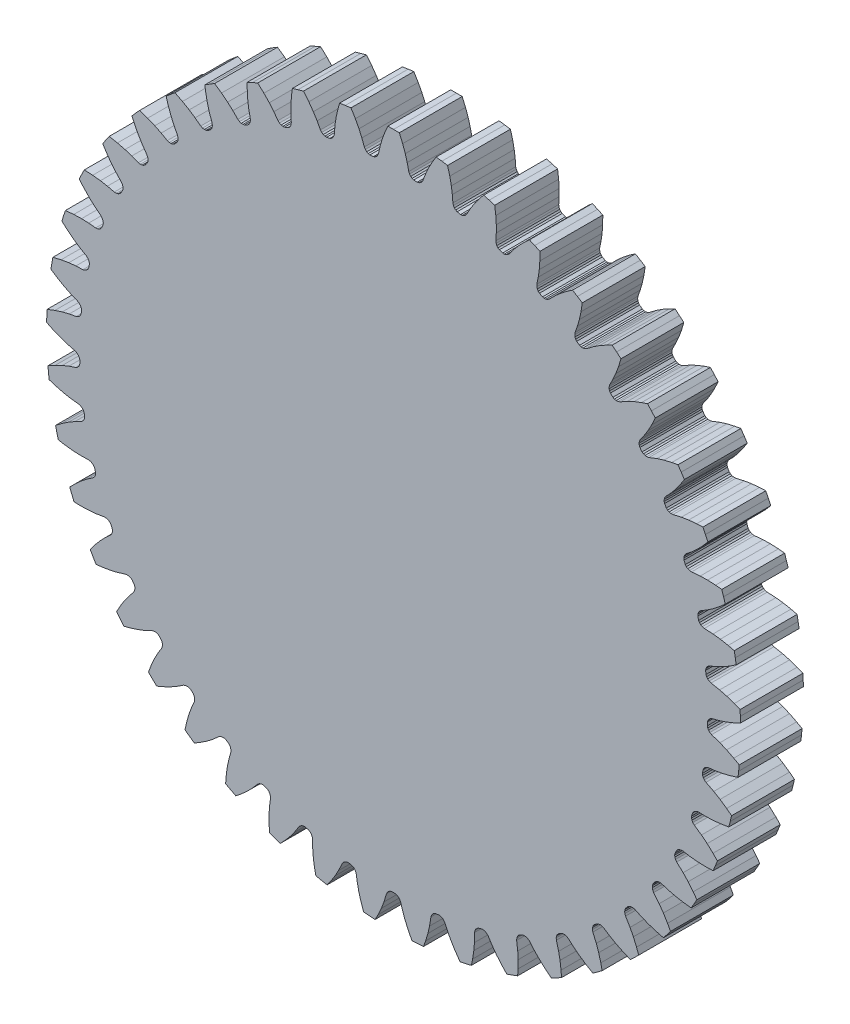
SolidWorks part; units mm, degrees
ref_plane "Ebene vorne" through (0, 0, 0) normal (0, 0, 1) x (1, 0, 0)
ref_plane "Ebene oben" through (0, 0, 0) normal (0, 1, 0) x (1, 0, 0)
ref_plane "Ebene rechts" through (0, 0, 0) normal (1, 0, 0) x (0, 0, -1)
sketch "Skizze1" plane through (0, 0, 0) normal (0, 0, 1) x (1, 0, 0)
  line L0 (1.1477, -5.3994) -> (1.058, -5.4177)
  line L1 (1.058, -5.4177) -> (0.9807, -5.3081)
  line L2 (0.9807, -5.3081) -> (0.9157, -5.2029)
  line L3 (0.9157, -5.2029) -> (0.8627, -5.1029)
  line L4 (0.8627, -5.1029) -> (0.816, -5.0004)
  line L5 (0.816, -5.0004) -> (0.7968, -4.9748)
  line L6 (0.7968, -4.9748) -> (0.7747, -4.9569)
  line L7 (0.7747, -4.9569) -> (0.749, -4.9457)
  line L8 (0.749, -4.9457) -> (0.7224, -4.9422)
  line L9 (0.7224, -4.9422) -> (0.6678, -4.9498)
  line L10 (0.6678, -4.9498) -> (0.6432, -4.9606)
  line L11 (0.6432, -4.9606) -> (0.6216, -4.9784)
  line L12 (0.6216, -4.9784) -> (0.6048, -5.0027)
  line L13 (0.6048, -5.0027) -> (0.5935, -5.0332)
  line L14 (0.5935, -5.0332) -> (0.5723, -5.1702)
  line L15 (0.5723, -5.1702) -> (0.5462, -5.2837)
  line L16 (0.5462, -5.2837) -> (0.5098, -5.4056)
  line L17 (0.5098, -5.4056) -> (0.4763, -5.4994)
  line L18 (0.4763, -5.4994) -> (0.3851, -5.5066)
  line L19 (1.888, -5.1871) -> (1.8017, -5.2177)
  line L20 (1.8017, -5.2177) -> (1.7099, -5.12)
  line L21 (1.7099, -5.12) -> (1.6309, -5.0248)
  line L22 (1.6309, -5.0248) -> (1.5645, -4.9332)
  line L23 (1.5645, -4.9332) -> (1.504, -4.8382)
  line L24 (1.504, -4.8382) -> (1.4814, -4.8155)
  line L25 (1.4814, -4.8155) -> (1.457, -4.8008)
  line L26 (1.457, -4.8008) -> (1.43, -4.7933)
  line L27 (1.43, -4.7933) -> (1.4032, -4.7935)
  line L28 (1.4032, -4.7935) -> (1.3502, -4.8087)
  line L29 (1.3502, -4.8087) -> (1.3274, -4.8228)
  line L30 (1.3274, -4.8228) -> (1.3084, -4.8435)
  line L31 (1.3084, -4.8435) -> (1.2951, -4.8698)
  line L32 (1.2951, -4.8698) -> (1.2882, -4.9016)
  line L33 (1.2882, -4.9016) -> (1.2863, -5.0402)
  line L34 (1.2863, -5.0402) -> (1.2763, -5.1563)
  line L35 (1.2763, -5.1563) -> (1.2571, -5.2821)
  line L36 (1.2571, -5.2821) -> (1.237, -5.3796)
  line L37 (1.237, -5.3796) -> (1.1477, -5.3994)
  line L38 (2.5915, -4.8739) -> (2.5103, -4.9162)
  line L39 (2.5103, -4.9162) -> (2.4058, -4.8322)
  line L40 (2.4058, -4.8322) -> (2.3143, -4.7489)
  line L41 (2.3143, -4.7489) -> (2.2359, -4.6675)
  line L42 (2.2359, -4.6675) -> (2.1627, -4.5818)
  line L43 (2.1627, -4.5818) -> (2.1372, -4.5624)
  line L44 (2.1372, -4.5624) -> (2.111, -4.5513)
  line L45 (2.111, -4.5513) -> (2.0832, -4.5477)
  line L46 (2.0832, -4.5477) -> (2.0567, -4.5516)
  line L47 (2.0567, -4.5516) -> (2.0063, -4.574)
  line L48 (2.0063, -4.574) -> (1.9856, -4.5911)
  line L49 (1.9856, -4.5911) -> (1.9698, -4.6142)
  line L50 (1.9698, -4.6142) -> (1.9603, -4.6422)
  line L51 (1.9603, -4.6422) -> (1.9579, -4.6747)
  line L52 (1.9579, -4.6747) -> (1.9752, -4.8121)
  line L53 (1.9752, -4.8121) -> (1.9815, -4.9285)
  line L54 (1.9815, -4.9285) -> (1.98, -5.0557)
  line L55 (1.98, -5.0557) -> (1.9737, -5.1551)
  line L56 (1.9737, -5.1551) -> (1.888, -5.1871)
  line L57 (3.2446, -4.4658) -> (3.1701, -4.5189)
  line L58 (3.1701, -4.5189) -> (3.0549, -4.4503)
  line L59 (3.0549, -4.4503) -> (2.9527, -4.3806)
  line L60 (2.9527, -4.3806) -> (2.8637, -4.3109)
  line L61 (2.8637, -4.3109) -> (2.7793, -4.2362)
  line L62 (2.7793, -4.2362) -> (2.7514, -4.2206)
  line L63 (2.7514, -4.2206) -> (2.7239, -4.2132)
  line L64 (2.7239, -4.2132) -> (2.6958, -4.2135)
  line L65 (2.6958, -4.2135) -> (2.6701, -4.2211)
  line L66 (2.6701, -4.2211) -> (2.6234, -4.2503)
  line L67 (2.6234, -4.2503) -> (2.6053, -4.2701)
  line L68 (2.6053, -4.2701) -> (2.5928, -4.2952)
  line L69 (2.5928, -4.2952) -> (2.5872, -4.3242)
  line L70 (2.5872, -4.3242) -> (2.5894, -4.3567)
  line L71 (2.5894, -4.3567) -> (2.6257, -4.4904)
  line L72 (2.6257, -4.4904) -> (2.6481, -4.6047)
  line L73 (2.6481, -4.6047) -> (2.6644, -4.7309)
  line L74 (2.6644, -4.7309) -> (2.6719, -4.8302)
  line L75 (2.6719, -4.8302) -> (2.5915, -4.8739)
  line L76 (3.8345, -3.9708) -> (3.7682, -4.0338)
  line L77 (3.7682, -4.0338) -> (3.6446, -3.9818)
  line L78 (3.6446, -3.9818) -> (3.5337, -3.9271)
  line L79 (3.5337, -3.9271) -> (3.4358, -3.8704)
  line L80 (3.4358, -3.8704) -> (3.3418, -3.8082)
  line L81 (3.3418, -3.8082) -> (3.312, -3.7966)
  line L82 (3.312, -3.7966) -> (3.2838, -3.7931)
  line L83 (3.2838, -3.7931) -> (3.256, -3.7973)
  line L84 (3.256, -3.7973) -> (3.2316, -3.8084)
  line L85 (3.2316, -3.8084) -> (3.1894, -3.8438)
  line L86 (3.1894, -3.8438) -> (3.1742, -3.8659)
  line L87 (3.1742, -3.8659) -> (3.1653, -3.8925)
  line L88 (3.1653, -3.8925) -> (3.1639, -3.922)
  line L89 (3.1639, -3.922) -> (3.1705, -3.9539)
  line L90 (3.1705, -3.9539) -> (3.2251, -4.0813)
  line L91 (3.2251, -4.0813) -> (3.2632, -4.1914)
  line L92 (3.2632, -4.1914) -> (3.2969, -4.3141)
  line L93 (3.2969, -4.3141) -> (3.3182, -4.4114)
  line L94 (3.3182, -4.4114) -> (3.2446, -4.4658)
  line L95 (4.3498, -3.3985) -> (4.2929, -3.4701)
  line L96 (4.2929, -3.4701) -> (4.1633, -3.4359)
  line L97 (4.1633, -3.4359) -> (4.0458, -3.397)
  line L98 (4.0458, -3.397) -> (3.941, -3.3545)
  line L99 (3.941, -3.3545) -> (3.8393, -3.306)
  line L100 (3.8393, -3.306) -> (3.8081, -3.2987)
  line L101 (3.8081, -3.2987) -> (3.7797, -3.2992)
  line L102 (3.7797, -3.2992) -> (3.7528, -3.3072)
  line L103 (3.7528, -3.3072) -> (3.7301, -3.3216)
  line L104 (3.7301, -3.3216) -> (3.6933, -3.3625)
  line L105 (3.6933, -3.3625) -> (3.6813, -3.3866)
  line L106 (3.6813, -3.3866) -> (3.6762, -3.4141)
  line L107 (3.6762, -3.4141) -> (3.6789, -3.4435)
  line L108 (3.6789, -3.4435) -> (3.69, -3.4742)
  line L109 (3.69, -3.4742) -> (3.7617, -3.5927)
  line L110 (3.7617, -3.5927) -> (3.8147, -3.6965)
  line L111 (3.8147, -3.6965) -> (3.8652, -3.8133)
  line L112 (3.8652, -3.8133) -> (3.8998, -3.9067)
  line L113 (3.8998, -3.9067) -> (3.8345, -3.9708)
  line L114 (4.7805, -2.76) -> (4.7341, -2.8389)
  line L115 (4.7341, -2.8389) -> (4.6009, -2.823)
  line L116 (4.6009, -2.823) -> (4.4792, -2.8009)
  line L117 (4.4792, -2.8009) -> (4.3695, -2.7734)
  line L118 (4.3695, -2.7734) -> (4.262, -2.7395)
  line L119 (4.262, -2.7395) -> (4.2302, -2.7366)
  line L120 (4.2302, -2.7366) -> (4.2021, -2.7411)
  line L121 (4.2021, -2.7411) -> (4.1766, -2.7527)
  line L122 (4.1766, -2.7527) -> (4.1561, -2.7701)
  line L123 (4.1561, -2.7701) -> (4.1253, -2.8158)
  line L124 (4.1253, -2.8158) -> (4.1168, -2.8413)
  line L125 (4.1168, -2.8413) -> (4.1156, -2.8693)
  line L126 (4.1156, -2.8693) -> (4.1224, -2.898)
  line L127 (4.1224, -2.898) -> (4.1376, -2.9268)
  line L128 (4.1376, -2.9268) -> (4.2251, -3.0342)
  line L129 (4.2251, -3.0342) -> (4.2921, -3.1296)
  line L130 (4.2921, -3.1296) -> (4.3583, -3.2382)
  line L131 (4.3583, -3.2382) -> (4.4056, -3.3259)
  line L132 (4.4056, -3.3259) -> (4.3498, -3.3985)
  line L133 (5.1181, -2.0678) -> (5.0831, -2.1524)
  line L134 (5.0831, -2.1524) -> (4.949, -2.1552)
  line L135 (4.949, -2.1552) -> (4.8255, -2.1503)
  line L136 (4.8255, -2.1503) -> (4.713, -2.1383)
  line L137 (4.713, -2.1383) -> (4.6018, -2.1197)
  line L138 (4.6018, -2.1197) -> (4.5699, -2.1213)
  line L139 (4.5699, -2.1213) -> (4.5427, -2.1296)
  line L140 (4.5427, -2.1296) -> (4.519, -2.1447)
  line L141 (4.519, -2.1447) -> (4.5012, -2.1647)
  line L142 (4.5012, -2.1647) -> (4.477, -2.2143)
  line L143 (4.477, -2.2143) -> (4.4722, -2.2407)
  line L144 (4.4722, -2.2407) -> (4.4749, -2.2686)
  line L145 (4.4749, -2.2686) -> (4.4856, -2.2961)
  line L146 (4.4856, -2.2961) -> (4.5046, -2.3225)
  line L147 (4.5046, -2.3225) -> (4.6063, -2.4167)
  line L148 (4.6063, -2.4167) -> (4.6858, -2.5018)
  line L149 (4.6858, -2.5018) -> (4.7665, -2.6001)
  line L150 (4.7665, -2.6001) -> (4.8256, -2.6804)
  line L151 (4.8256, -2.6804) -> (4.7805, -2.76)
  line L152 (5.356, -1.3354) -> (5.3332, -1.424)
  line L153 (5.3332, -1.424) -> (5.2008, -1.4455)
  line L154 (5.2008, -1.4455) -> (5.0777, -1.4578)
  line L155 (5.0777, -1.4578) -> (4.9647, -1.4616)
  line L156 (4.9647, -1.4616) -> (4.8521, -1.4586)
  line L157 (4.8521, -1.4586) -> (4.8206, -1.4646)
  line L158 (4.8206, -1.4646) -> (4.7948, -1.4766)
  line L159 (4.7948, -1.4766) -> (4.7735, -1.4949)
  line L160 (4.7735, -1.4949) -> (4.7587, -1.5172)
  line L161 (4.7587, -1.5172) -> (4.7416, -1.5696)
  line L162 (4.7416, -1.5696) -> (4.7405, -1.5964)
  line L163 (4.7405, -1.5964) -> (4.7471, -1.6237)
  line L164 (4.7471, -1.6237) -> (4.7615, -1.6495)
  line L165 (4.7615, -1.6495) -> (4.784, -1.673)
  line L166 (4.784, -1.673) -> (4.8978, -1.7521)
  line L167 (4.8978, -1.7521) -> (4.9884, -1.8253)
  line L168 (4.9884, -1.8253) -> (5.082, -1.9115)
  line L169 (5.082, -1.9115) -> (5.1516, -1.9827)
  line L170 (5.1516, -1.9827) -> (5.1181, -2.0678)
  line L171 (5.4898, -0.577) -> (5.4794, -0.6679)
  line L172 (5.4794, -0.6679) -> (5.3514, -0.7076)
  line L173 (5.3514, -0.7076) -> (5.2312, -0.7369)
  line L174 (5.2312, -0.7369) -> (5.1198, -0.7564)
  line L175 (5.1198, -0.7564) -> (5.0078, -0.7692)
  line L176 (5.0078, -0.7692) -> (4.9775, -0.7795)
  line L177 (4.9775, -0.7795) -> (4.9537, -0.795)
  line L178 (4.9537, -0.795) -> (4.9351, -0.816)
  line L179 (4.9351, -0.816) -> (4.9235, -0.8402)
  line L180 (4.9235, -0.8402) -> (4.9139, -0.8944)
  line L181 (4.9139, -0.8944) -> (4.9166, -0.9211)
  line L182 (4.9166, -0.9211) -> (4.9268, -0.9472)
  line L183 (4.9268, -0.9472) -> (4.9447, -0.9707)
  line L184 (4.9447, -0.9707) -> (4.9703, -0.9909)
  line L185 (4.9703, -0.9909) -> (5.094, -1.0534)
  line L186 (5.094, -1.0534) -> (5.1939, -1.1133)
  line L187 (5.1939, -1.1133) -> (5.2986, -1.1856)
  line L188 (5.2986, -1.1856) -> (5.3774, -1.2464)
  line L189 (5.3774, -1.2464) -> (5.356, -1.3354)
  line L190 (5.5166, 0.1926) -> (5.5191, 0.1012)
  line L191 (5.5191, 0.1012) -> (5.3978, 0.0441)
  line L192 (5.3978, 0.0441) -> (5.2829, -0.0017)
  line L193 (5.2829, -0.0017) -> (5.1752, -0.0365)
  line L194 (5.1752, -0.0365) -> (5.0662, -0.0647)
  line L195 (5.0662, -0.0647) -> (5.0376, -0.0791)
  line L196 (5.0376, -0.0791) -> (5.0161, -0.0978)
  line L197 (5.0161, -0.0978) -> (5.0006, -0.1212)
  line L198 (5.0006, -0.1212) -> (4.9925, -0.1468)
  line L199 (4.9925, -0.1468) -> (4.9906, -0.2018)
  line L200 (4.9906, -0.2018) -> (4.9969, -0.2279)
  line L201 (4.9969, -0.2279) -> (5.0107, -0.2523)
  line L202 (5.0107, -0.2523) -> (5.0317, -0.2731)
  line L203 (5.0317, -0.2731) -> (5.0598, -0.2895)
  line L204 (5.0598, -0.2895) -> (5.191, -0.3342)
  line L205 (5.191, -0.3342) -> (5.2983, -0.3796)
  line L206 (5.2983, -0.3796) -> (5.412, -0.4366)
  line L207 (5.412, -0.4366) -> (5.4986, -0.4859)
  line L208 (5.4986, -0.4859) -> (5.4898, -0.577)
  line L209 (5.4361, 0.9585) -> (5.4513, 0.8683)
  line L210 (5.4513, 0.8683) -> (5.3391, 0.7949)
  line L211 (5.3391, 0.7949) -> (5.2317, 0.7336)
  line L212 (5.2317, 0.7336) -> (5.1299, 0.6841)
  line L213 (5.1299, 0.6841) -> (5.0259, 0.641)
  line L214 (5.0259, 0.641) -> (4.9995, 0.6227)
  line L215 (4.9995, 0.6227) -> (4.9809, 0.6013)
  line L216 (4.9809, 0.6013) -> (4.9688, 0.5759)
  line L217 (4.9688, 0.5759) -> (4.9644, 0.5495)
  line L218 (4.9644, 0.5495) -> (4.9701, 0.4947)
  line L219 (4.9701, 0.4947) -> (4.98, 0.4697)
  line L220 (4.98, 0.4697) -> (4.9971, 0.4475)
  line L221 (4.9971, 0.4475) -> (5.0207, 0.4298)
  line L222 (5.0207, 0.4298) -> (5.0509, 0.4175)
  line L223 (5.0509, 0.4175) -> (5.187, 0.3915)
  line L224 (5.187, 0.3915) -> (5.2996, 0.3615)
  line L225 (5.2996, 0.3615) -> (5.4201, 0.3208)
  line L226 (5.4201, 0.3208) -> (5.5127, 0.2841)
  line L227 (5.5127, 0.2841) -> (5.5166, 0.1926)
  line L228 (5.2498, 1.7058) -> (5.2774, 1.6185)
  line L229 (5.2774, 1.6185) -> (5.1765, 1.5302)
  line L230 (5.1765, 1.5302) -> (5.0787, 1.4545)
  line L231 (5.0787, 1.4545) -> (4.9848, 1.3914)
  line L232 (4.9848, 1.3914) -> (4.8877, 1.3342)
  line L233 (4.8877, 1.3342) -> (4.8642, 1.3125)
  line L234 (4.8642, 1.3125) -> (4.8488, 1.2886)
  line L235 (4.8488, 1.2886) -> (4.8403, 1.2619)
  line L236 (4.8403, 1.2619) -> (4.8396, 1.235)
  line L237 (4.8396, 1.235) -> (4.8529, 1.1816)
  line L238 (4.8529, 1.1816) -> (4.8662, 1.1582)
  line L239 (4.8662, 1.1582) -> (4.8862, 1.1386)
  line L240 (4.8862, 1.1386) -> (4.912, 1.1244)
  line L241 (4.912, 1.1244) -> (4.9436, 1.1164)
  line L242 (4.9436, 1.1164) -> (5.082, 1.1096)
  line L243 (5.082, 1.1096) -> (5.1977, 1.0955)
  line L244 (5.1977, 1.0955) -> (5.3227, 1.072)
  line L245 (5.3227, 1.072) -> (5.4195, 1.0485)
  line L246 (5.4195, 1.0485) -> (5.4361, 0.9585)
  line L247 (4.9613, 2.4198) -> (5.0008, 2.3372)
  line L248 (5.0008, 2.3372) -> (4.9132, 2.2357)
  line L249 (4.9132, 2.2357) -> (4.8268, 2.1472)
  line L250 (4.8268, 2.1472) -> (4.7426, 2.0716)
  line L251 (4.7426, 2.0716) -> (4.6545, 2.0015)
  line L252 (4.6545, 2.0015) -> (4.6342, 1.9767)
  line L253 (4.6342, 1.9767) -> (4.6222, 1.9509)
  line L254 (4.6222, 1.9509) -> (4.6176, 1.9232)
  line L255 (4.6176, 1.9232) -> (4.6206, 1.8966)
  line L256 (4.6206, 1.8966) -> (4.6412, 1.8455)
  line L257 (4.6412, 1.8455) -> (4.6576, 1.8242)
  line L258 (4.6576, 1.8242) -> (4.6802, 1.8075)
  line L259 (4.6802, 1.8075) -> (4.7077, 1.7971)
  line L260 (4.7077, 1.7971) -> (4.7401, 1.7935)
  line L261 (4.7401, 1.7935) -> (4.8782, 1.8061)
  line L262 (4.8782, 1.8061) -> (4.9946, 1.8082)
  line L263 (4.9946, 1.8082) -> (5.1217, 1.8024)
  line L264 (5.1217, 1.8024) -> (5.2208, 1.7926)
  line L265 (5.2208, 1.7926) -> (5.2498, 1.7058)
  line L266 (4.5763, 3.0867) -> (4.6268, 3.0105)
  line L267 (4.6268, 3.0105) -> (4.5542, 2.8977)
  line L268 (4.5542, 2.8977) -> (4.481, 2.7981)
  line L269 (4.481, 2.7981) -> (4.4082, 2.7115)
  line L270 (4.4082, 2.7115) -> (4.3306, 2.6298)
  line L271 (4.3306, 2.6298) -> (4.314, 2.6024)
  line L272 (4.314, 2.6024) -> (4.3057, 2.5752)
  line L273 (4.3057, 2.5752) -> (4.305, 2.5472)
  line L274 (4.305, 2.5472) -> (4.3117, 2.5212)
  line L275 (4.3117, 2.5212) -> (4.3392, 2.4734)
  line L276 (4.3392, 2.4734) -> (4.3584, 2.4547)
  line L277 (4.3584, 2.4547) -> (4.3831, 2.4413)
  line L278 (4.3831, 2.4413) -> (4.4118, 2.4348)
  line L279 (4.4118, 2.4348) -> (4.4444, 2.4358)
  line L280 (4.4444, 2.4358) -> (4.5793, 2.4674)
  line L281 (4.5793, 2.4674) -> (4.6944, 2.4858)
  line L282 (4.6944, 2.4858) -> (4.821, 2.4976)
  line L283 (4.821, 2.4976) -> (4.9206, 2.5017)
  line L284 (4.9206, 2.5017) -> (4.9613, 2.4198)
  line L285 (4.1022, 3.6936) -> (4.1628, 3.6251)
  line L286 (4.1628, 3.6251) -> (4.1066, 3.5034)
  line L287 (4.1066, 3.5034) -> (4.048, 3.3945)
  line L288 (4.048, 3.3945) -> (3.9879, 3.2986)
  line L289 (3.9879, 3.2986) -> (3.9225, 3.2069)
  line L290 (3.9225, 3.2069) -> (3.9099, 3.1775)
  line L291 (3.9099, 3.1775) -> (3.9054, 3.1494)
  line L292 (3.9054, 3.1494) -> (3.9086, 3.1215)
  line L293 (3.9086, 3.1215) -> (3.9188, 3.0967)
  line L294 (3.9188, 3.0967) -> (3.9528, 3.0533)
  line L295 (3.9528, 3.0533) -> (3.9744, 3.0374)
  line L296 (3.9744, 3.0374) -> (4.0006, 3.0275)
  line L297 (4.0006, 3.0275) -> (4.03, 3.0251)
  line L298 (4.03, 3.0251) -> (4.0621, 3.0306)
  line L299 (4.0621, 3.0306) -> (4.1914, 3.0807)
  line L300 (4.1914, 3.0807) -> (4.3027, 3.1149)
  line L301 (4.3027, 3.1149) -> (4.4265, 3.1443)
  line L302 (4.4265, 3.1443) -> (4.5245, 3.1622)
  line L303 (4.5245, 3.1622) -> (4.5763, 3.0867)
  line L304 (3.5482, 4.2286) -> (3.6178, 4.1692)
  line L305 (3.6178, 4.1692) -> (3.5791, 4.0408)
  line L306 (3.5791, 4.0408) -> (3.5362, 3.9248)
  line L307 (3.5362, 3.9248) -> (3.49, 3.8215)
  line L308 (3.49, 3.8215) -> (3.438, 3.7216)
  line L309 (3.438, 3.7216) -> (3.4296, 3.6907)
  line L310 (3.4296, 3.6907) -> (3.4291, 3.6623)
  line L311 (3.4291, 3.6623) -> (3.4361, 3.6351)
  line L312 (3.4361, 3.6351) -> (3.4497, 3.612)
  line L313 (3.4497, 3.612) -> (3.4894, 3.5737)
  line L314 (3.4894, 3.5737) -> (3.513, 3.5609)
  line L315 (3.513, 3.5609) -> (3.5404, 3.5548)
  line L316 (3.5404, 3.5548) -> (3.5698, 3.5565)
  line L317 (3.5698, 3.5565) -> (3.6008, 3.5665)
  line L318 (3.6008, 3.5665) -> (3.7218, 3.634)
  line L319 (3.7218, 3.634) -> (3.8273, 3.6834)
  line L320 (3.8273, 3.6834) -> (3.9458, 3.7297)
  line L321 (3.9458, 3.7297) -> (4.0404, 3.7611)
  line L322 (4.0404, 3.7611) -> (4.1022, 3.6936)
  line L323 (2.9252, 4.6812) -> (3.0023, 4.6321)
  line L324 (3.0023, 4.6321) -> (2.9819, 4.4996)
  line L325 (2.9819, 4.4996) -> (2.9555, 4.3788)
  line L326 (2.9555, 4.3788) -> (2.9242, 4.2701)
  line L327 (2.9242, 4.2701) -> (2.8866, 4.1638)
  line L328 (2.8866, 4.1638) -> (2.8826, 4.1321)
  line L329 (2.8826, 4.1321) -> (2.8861, 4.1039)
  line L330 (2.8861, 4.1039) -> (2.8968, 4.0779)
  line L331 (2.8968, 4.0779) -> (2.9135, 4.0569)
  line L332 (2.9135, 4.0569) -> (2.958, 4.0245)
  line L333 (2.958, 4.0245) -> (2.9832, 4.0152)
  line L334 (2.9832, 4.0152) -> (3.0112, 4.013)
  line L335 (3.0112, 4.013) -> (3.0401, 4.0187)
  line L336 (3.0401, 4.0187) -> (3.0694, 4.0329)
  line L337 (3.0694, 4.0329) -> (3.1798, 4.1166)
  line L338 (3.1798, 4.1166) -> (3.2775, 4.1802)
  line L339 (3.2775, 4.1802) -> (3.3883, 4.2426)
  line L340 (3.3883, 4.2426) -> (3.4776, 4.2868)
  line L341 (3.4776, 4.2868) -> (3.5482, 4.2286)
  line L342 (2.2452, 5.0428) -> (2.3285, 5.0049)
  line L343 (2.3285, 5.0049) -> (2.3266, 4.8708)
  line L344 (2.3266, 4.8708) -> (2.3174, 4.7475)
  line L345 (2.3174, 4.7475) -> (2.3015, 4.6355)
  line L346 (2.3015, 4.6355) -> (2.279, 4.5251)
  line L347 (2.279, 4.5251) -> (2.2794, 4.493)
  line L348 (2.2794, 4.493) -> (2.2868, 4.4656)
  line L349 (2.2868, 4.4656) -> (2.3011, 4.4414)
  line L350 (2.3011, 4.4414) -> (2.3205, 4.4229)
  line L351 (2.3205, 4.4229) -> (2.3692, 4.397)
  line L352 (2.3692, 4.397) -> (2.3954, 4.3913)
  line L353 (2.3954, 4.3913) -> (2.4234, 4.393)
  line L354 (2.4234, 4.393) -> (2.4512, 4.4027)
  line L355 (2.4512, 4.4027) -> (2.4783, 4.4208)
  line L356 (2.4783, 4.4208) -> (2.576, 4.5191)
  line L357 (2.576, 4.5191) -> (2.6638, 4.5957)
  line L358 (2.6638, 4.5957) -> (2.7649, 4.6729)
  line L359 (2.7649, 4.6729) -> (2.8472, 4.7291)
  line L360 (2.8472, 4.7291) -> (2.9252, 4.6812)
  line L361 (1.5215, 5.3062) -> (1.6093, 5.2802)
  line L362 (1.6093, 5.2802) -> (1.6261, 5.1472)
  line L363 (1.6261, 5.1472) -> (1.6341, 5.0238)
  line L364 (1.6341, 5.0238) -> (1.6339, 4.9107)
  line L365 (1.6339, 4.9107) -> (1.6271, 4.7982)
  line L366 (1.6271, 4.7982) -> (1.632, 4.7666)
  line L367 (1.632, 4.7666) -> (1.6431, 4.7404)
  line L368 (1.6431, 4.7404) -> (1.6605, 4.7184)
  line L369 (1.6605, 4.7184) -> (1.6824, 4.7028)
  line L370 (1.6824, 4.7028) -> (1.7341, 4.684)
  line L371 (1.7341, 4.684) -> (1.7609, 4.6819)
  line L372 (1.7609, 4.6819) -> (1.7884, 4.6875)
  line L373 (1.7884, 4.6875) -> (1.8146, 4.701)
  line L374 (1.8146, 4.701) -> (1.8389, 4.7227)
  line L375 (1.8389, 4.7227) -> (1.922, 4.8337)
  line L376 (1.922, 4.8337) -> (1.9983, 4.9217)
  line L377 (1.9983, 4.9217) -> (2.0877, 5.0122)
  line L378 (2.0877, 5.0122) -> (2.1613, 5.0793)
  line L379 (2.1613, 5.0793) -> (2.2452, 5.0428)
  line L380 (0.7682, 5.4663) -> (0.8587, 5.4528)
  line L381 (0.8587, 5.4528) -> (0.8939, 5.3234)
  line L382 (0.8939, 5.3234) -> (0.919, 5.2023)
  line L383 (0.919, 5.2023) -> (0.9346, 5.0903)
  line L384 (0.9346, 5.0903) -> (0.9435, 4.9779)
  line L385 (0.9435, 4.9779) -> (0.9527, 4.9473)
  line L386 (0.9527, 4.9473) -> (0.9674, 4.9229)
  line L387 (0.9674, 4.9229) -> (0.9877, 4.9036)
  line L388 (0.9877, 4.9036) -> (1.0115, 4.8912)
  line L389 (1.0115, 4.8912) -> (1.0654, 4.8797)
  line L390 (1.0654, 4.8797) -> (1.0922, 4.8814)
  line L391 (1.0922, 4.8814) -> (1.1186, 4.8908)
  line L392 (1.1186, 4.8908) -> (1.1427, 4.9078)
  line L393 (1.1427, 4.9078) -> (1.1637, 4.9327)
  line L394 (1.1637, 4.9327) -> (1.2305, 5.0541)
  line L395 (1.2305, 5.0541) -> (1.2939, 5.1519)
  line L396 (1.2939, 5.1519) -> (1.3698, 5.254)
  line L397 (1.3698, 5.254) -> (1.4334, 5.3307)
  line L398 (1.4334, 5.3307) -> (1.5215, 5.3062)
  line L399 (0, 5.52) -> (0.0915, 5.5192)
  line L400 (0.0915, 5.5192) -> (0.1443, 5.396)
  line L401 (0.1443, 5.396) -> (0.186, 5.2796)
  line L402 (0.186, 5.2796) -> (0.2171, 5.1708)
  line L403 (0.2171, 5.1708) -> (0.2415, 5.0608)
  line L404 (0.2415, 5.0608) -> (0.2549, 5.0317)
  line L405 (0.2549, 5.0317) -> (0.2728, 5.0097)
  line L406 (0.2728, 5.0097) -> (0.2956, 4.9934)
  line L407 (0.2956, 4.9934) -> (0.3209, 4.9844)
  line L408 (0.3209, 4.9844) -> (0.3759, 4.9805)
  line L409 (0.3759, 4.9805) -> (0.4022, 4.9859)
  line L410 (0.4022, 4.9859) -> (0.4271, 4.9989)
  line L411 (0.4271, 4.9989) -> (0.4486, 5.0191)
  line L412 (0.4486, 5.0191) -> (0.4659, 5.0466)
  line L413 (0.4659, 5.0466) -> (0.5152, 5.1762)
  line L414 (0.5152, 5.1762) -> (0.5643, 5.2818)
  line L415 (0.5643, 5.2818) -> (0.6252, 5.3935)
  line L416 (0.6252, 5.3935) -> (0.6775, 5.4783)
  line L417 (0.6775, 5.4783) -> (0.7682, 5.4663)
  line L418 (-0.7682, 5.4663) -> (-0.6775, 5.4783)
  line L419 (-0.6775, 5.4783) -> (-0.608, 5.3636)
  line L420 (-0.608, 5.3636) -> (-0.5505, 5.2541)
  line L421 (-0.5505, 5.2541) -> (-0.5047, 5.1507)
  line L422 (-0.5047, 5.1507) -> (-0.4652, 5.0452)
  line L423 (-0.4652, 5.0452) -> (-0.4479, 5.0182)
  line L424 (-0.4479, 5.0182) -> (-0.4271, 4.9989)
  line L425 (-0.4271, 4.9989) -> (-0.4022, 4.9859)
  line L426 (-0.4022, 4.9859) -> (-0.3759, 4.9805)
  line L427 (-0.3759, 4.9805) -> (-0.3209, 4.9844)
  line L428 (-0.3209, 4.9844) -> (-0.2956, 4.9934)
  line L429 (-0.2956, 4.9934) -> (-0.2728, 5.0097)
  line L430 (-0.2728, 5.0097) -> (-0.2543, 5.0327)
  line L431 (-0.2543, 5.0327) -> (-0.241, 5.0624)
  line L432 (-0.241, 5.0624) -> (-0.2102, 5.1975)
  line L433 (-0.2102, 5.1975) -> (-0.1763, 5.3089)
  line L434 (-0.1763, 5.3089) -> (-0.1315, 5.428)
  line L435 (-0.1315, 5.428) -> (-0.0915, 5.5192)
  line L436 (-0.0915, 5.5192) -> (0, 5.52)
  line L437 (-1.5215, 5.3062) -> (-1.4334, 5.3307)
  line L438 (-1.4334, 5.3307) -> (-1.3486, 5.2268)
  line L439 (-1.3486, 5.2268) -> (-1.2764, 5.1263)
  line L440 (-1.2764, 5.1263) -> (-1.2166, 5.0303)
  line L441 (-1.2166, 5.0303) -> (-1.1628, 4.9313)
  line L442 (-1.1628, 4.9313) -> (-1.1419, 4.9071)
  line L443 (-1.1419, 4.9071) -> (-1.1186, 4.8908)
  line L444 (-1.1186, 4.8908) -> (-1.0922, 4.8814)
  line L445 (-1.0922, 4.8814) -> (-1.0654, 4.8797)
  line L446 (-1.0654, 4.8797) -> (-1.0115, 4.8912)
  line L447 (-1.0115, 4.8912) -> (-0.9877, 4.9036)
  line L448 (-0.9877, 4.9036) -> (-0.9674, 4.9229)
  line L449 (-0.9674, 4.9229) -> (-0.9523, 4.9483)
  line L450 (-0.9523, 4.9483) -> (-0.9432, 4.9796)
  line L451 (-0.9432, 4.9796) -> (-0.9315, 5.1177)
  line L452 (-0.9315, 5.1177) -> (-0.9135, 5.2327)
  line L453 (-0.9135, 5.2327) -> (-0.8856, 5.3569)
  line L454 (-0.8856, 5.3569) -> (-0.8587, 5.4528)
  line L455 (-0.8587, 5.4528) -> (-0.7682, 5.4663)
  line L456 (-2.2452, 5.0428) -> (-2.1613, 5.0793)
  line L457 (-2.1613, 5.0793) -> (-2.0629, 4.9882)
  line L458 (-2.0629, 4.9882) -> (-1.9774, 4.8988)
  line L459 (-1.9774, 4.8988) -> (-1.9049, 4.8121)
  line L460 (-1.9049, 4.8121) -> (-1.8378, 4.7215)
  line L461 (-1.8378, 4.7215) -> (-1.8137, 4.7004)
  line L462 (-1.8137, 4.7004) -> (-1.7884, 4.6875)
  line L463 (-1.7884, 4.6875) -> (-1.7609, 4.6819)
  line L464 (-1.7609, 4.6819) -> (-1.7341, 4.684)
  line L465 (-1.7341, 4.684) -> (-1.6824, 4.7028)
  line L466 (-1.6824, 4.7028) -> (-1.6605, 4.7184)
  line L467 (-1.6605, 4.7184) -> (-1.6431, 4.7404)
  line L468 (-1.6431, 4.7404) -> (-1.6317, 4.7676)
  line L469 (-1.6317, 4.7676) -> (-1.627, 4.7998)
  line L470 (-1.627, 4.7998) -> (-1.6347, 4.9382)
  line L471 (-1.6347, 4.9382) -> (-1.6328, 5.0547)
  line L472 (-1.6328, 5.0547) -> (-1.6225, 5.1815)
  line L473 (-1.6225, 5.1815) -> (-1.6093, 5.2802)
  line L474 (-1.6093, 5.2802) -> (-1.5215, 5.3062)
  line L475 (-2.9252, 4.6812) -> (-2.8472, 4.7291)
  line L476 (-2.8472, 4.7291) -> (-2.737, 4.6526)
  line L477 (-2.737, 4.6526) -> (-2.64, 4.5759)
  line L478 (-2.64, 4.5759) -> (-2.556, 4.5001)
  line L479 (-2.556, 4.5001) -> (-2.477, 4.4198)
  line L480 (-2.477, 4.4198) -> (-2.4502, 4.4022)
  line L481 (-2.4502, 4.4022) -> (-2.4234, 4.393)
  line L482 (-2.4234, 4.393) -> (-2.3954, 4.3913)
  line L483 (-2.3954, 4.3913) -> (-2.3692, 4.397)
  line L484 (-2.3692, 4.397) -> (-2.3205, 4.4229)
  line L485 (-2.3205, 4.4229) -> (-2.3011, 4.4414)
  line L486 (-2.3011, 4.4414) -> (-2.2868, 4.4656)
  line L487 (-2.2868, 4.4656) -> (-2.2793, 4.4941)
  line L488 (-2.2793, 4.4941) -> (-2.2792, 4.5267)
  line L489 (-2.2792, 4.5267) -> (-2.3061, 4.6626)
  line L490 (-2.3061, 4.6626) -> (-2.3204, 4.7783)
  line L491 (-2.3204, 4.7783) -> (-2.3279, 4.9053)
  line L492 (-2.3279, 4.9053) -> (-2.3285, 5.0049)
  line L493 (-2.3285, 5.0049) -> (-2.2452, 5.0428)
  line L494 (-3.5482, 4.2286) -> (-3.4776, 4.2868)
  line L495 (-3.4776, 4.2868) -> (-3.3579, 4.2264)
  line L496 (-3.3579, 4.2264) -> (-3.2511, 4.164)
  line L497 (-3.2511, 4.164) -> (-3.1574, 4.1006)
  line L498 (-3.1574, 4.1006) -> (-3.068, 4.032)
  line L499 (-3.068, 4.032) -> (-3.0391, 4.0184)
  line L500 (-3.0391, 4.0184) -> (-3.0112, 4.013)
  line L501 (-3.0112, 4.013) -> (-2.9832, 4.0152)
  line L502 (-2.9832, 4.0152) -> (-2.958, 4.0245)
  line L503 (-2.958, 4.0245) -> (-2.9135, 4.0569)
  line L504 (-2.9135, 4.0569) -> (-2.8968, 4.0779)
  line L505 (-2.8968, 4.0779) -> (-2.8861, 4.1039)
  line L506 (-2.8861, 4.1039) -> (-2.8826, 4.1332)
  line L507 (-2.8826, 4.1332) -> (-2.887, 4.1654)
  line L508 (-2.887, 4.1654) -> (-2.9325, 4.2963)
  line L509 (-2.9325, 4.2963) -> (-2.9628, 4.4088)
  line L510 (-2.9628, 4.4088) -> (-2.9879, 4.5335)
  line L511 (-2.9879, 4.5335) -> (-3.0023, 4.6321)
  line L512 (-3.0023, 4.6321) -> (-2.9252, 4.6812)
  line L513 (-4.1022, 3.6936) -> (-4.0404, 3.7611)
  line L514 (-4.0404, 3.7611) -> (-3.9134, 3.7179)
  line L515 (-3.9134, 3.7179) -> (-3.799, 3.671)
  line L516 (-3.799, 3.671) -> (-3.6974, 3.6213)
  line L517 (-3.6974, 3.6213) -> (-3.5993, 3.5658)
  line L518 (-3.5993, 3.5658) -> (-3.5687, 3.5563)
  line L519 (-3.5687, 3.5563) -> (-3.5404, 3.5548)
  line L520 (-3.5404, 3.5548) -> (-3.513, 3.5609)
  line L521 (-3.513, 3.5609) -> (-3.4894, 3.5737)
  line L522 (-3.4894, 3.5737) -> (-3.4497, 3.612)
  line L523 (-3.4497, 3.612) -> (-3.4361, 3.6351)
  line L524 (-3.4361, 3.6351) -> (-3.4291, 3.6623)
  line L525 (-3.4291, 3.6623) -> (-3.4298, 3.6918)
  line L526 (-3.4298, 3.6918) -> (-3.4386, 3.7231)
  line L527 (-3.4386, 3.7231) -> (-3.5019, 3.8464)
  line L528 (-3.5019, 3.8464) -> (-3.5476, 3.9536)
  line L529 (-3.5476, 3.9536) -> (-3.5898, 4.0736)
  line L530 (-3.5898, 4.0736) -> (-3.6178, 4.1692)
  line L531 (-3.6178, 4.1692) -> (-3.5482, 4.2286)
  line L532 (-4.5763, 3.0867) -> (-4.5245, 3.1622)
  line L533 (-4.5245, 3.1622) -> (-4.3928, 3.1371)
  line L534 (-4.3928, 3.1371) -> (-4.2729, 3.1065)
  line L535 (-4.2729, 3.1065) -> (-4.1654, 3.0714)
  line L536 (-4.1654, 3.0714) -> (-4.0606, 3.0302)
  line L537 (-4.0606, 3.0302) -> (-4.029, 3.025)
  line L538 (-4.029, 3.025) -> (-4.0006, 3.0275)
  line L539 (-4.0006, 3.0275) -> (-3.9744, 3.0374)
  line L540 (-3.9744, 3.0374) -> (-3.9528, 3.0533)
  line L541 (-3.9528, 3.0533) -> (-3.9188, 3.0967)
  line L542 (-3.9188, 3.0967) -> (-3.9086, 3.1215)
  line L543 (-3.9086, 3.1215) -> (-3.9054, 3.1494)
  line L544 (-3.9054, 3.1494) -> (-3.9102, 3.1785)
  line L545 (-3.9102, 3.1785) -> (-3.9233, 3.2083)
  line L546 (-3.9233, 3.2083) -> (-4.0032, 3.3216)
  line L547 (-4.0032, 3.3216) -> (-4.0633, 3.4213)
  line L548 (-4.0633, 3.4213) -> (-4.1218, 3.5343)
  line L549 (-4.1218, 3.5343) -> (-4.1628, 3.6251)
  line L550 (-4.1628, 3.6251) -> (-4.1022, 3.6936)
  line L551 (-4.9613, 2.4198) -> (-4.9206, 2.5017)
  line L552 (-4.9206, 2.5017) -> (-4.7866, 2.4952)
  line L553 (-4.7866, 2.4952) -> (-4.6637, 2.4816)
  line L554 (-4.6637, 2.4816) -> (-4.5523, 2.4618)
  line L555 (-4.5523, 2.4618) -> (-4.4428, 2.4356)
  line L556 (-4.4428, 2.4356) -> (-4.4108, 2.4349)
  line L557 (-4.4108, 2.4349) -> (-4.3831, 2.4413)
  line L558 (-4.3831, 2.4413) -> (-4.3584, 2.4547)
  line L559 (-4.3584, 2.4547) -> (-4.3392, 2.4734)
  line L560 (-4.3392, 2.4734) -> (-4.3117, 2.5212)
  line L561 (-4.3117, 2.5212) -> (-4.305, 2.5472)
  line L562 (-4.305, 2.5472) -> (-4.3057, 2.5752)
  line L563 (-4.3057, 2.5752) -> (-4.3145, 2.6034)
  line L564 (-4.3145, 2.6034) -> (-4.3317, 2.6311)
  line L565 (-4.3317, 2.6311) -> (-4.4265, 2.7321)
  line L566 (-4.4265, 2.7321) -> (-4.4999, 2.8225)
  line L567 (-4.4999, 2.8225) -> (-4.5735, 2.9263)
  line L568 (-4.5735, 2.9263) -> (-4.6268, 3.0105)
  line L569 (-4.6268, 3.0105) -> (-4.5763, 3.0867)
  line L570 (-5.2498, 1.7058) -> (-5.2208, 1.7926)
  line L571 (-5.2208, 1.7926) -> (-5.0873, 1.8047)
  line L572 (-5.0873, 1.8047) -> (-4.9637, 1.8084)
  line L573 (-4.9637, 1.8084) -> (-4.8506, 1.8043)
  line L574 (-4.8506, 1.8043) -> (-4.7385, 1.7936)
  line L575 (-4.7385, 1.7936) -> (-4.7067, 1.7973)
  line L576 (-4.7067, 1.7973) -> (-4.6802, 1.8075)
  line L577 (-4.6802, 1.8075) -> (-4.6576, 1.8242)
  line L578 (-4.6576, 1.8242) -> (-4.6412, 1.8455)
  line L579 (-4.6412, 1.8455) -> (-4.6206, 1.8966)
  line L580 (-4.6206, 1.8966) -> (-4.6176, 1.9232)
  line L581 (-4.6176, 1.9232) -> (-4.6222, 1.9509)
  line L582 (-4.6222, 1.9509) -> (-4.6348, 1.9776)
  line L583 (-4.6348, 1.9776) -> (-4.6557, 2.0026)
  line L584 (-4.6557, 2.0026) -> (-4.7636, 2.0895)
  line L585 (-4.7636, 2.0895) -> (-4.8489, 2.1688)
  line L586 (-4.8489, 2.1688) -> (-4.9363, 2.2613)
  line L587 (-4.9363, 2.2613) -> (-5.0008, 2.3372)
  line L588 (-5.0008, 2.3372) -> (-4.9613, 2.4198)
  line L589 (-5.4361, 0.9585) -> (-5.4195, 1.0485)
  line L590 (-5.4195, 1.0485) -> (-5.289, 1.0792)
  line L591 (-5.289, 1.0792) -> (-5.1671, 1.1)
  line L592 (-5.1671, 1.1) -> (-5.0546, 1.1117)
  line L593 (-5.0546, 1.1117) -> (-4.942, 1.1166)
  line L594 (-4.942, 1.1166) -> (-4.911, 1.1248)
  line L595 (-4.911, 1.1248) -> (-4.8862, 1.1386)
  line L596 (-4.8862, 1.1386) -> (-4.8662, 1.1582)
  line L597 (-4.8662, 1.1582) -> (-4.8529, 1.1816)
  line L598 (-4.8529, 1.1816) -> (-4.8396, 1.235)
  line L599 (-4.8396, 1.235) -> (-4.8403, 1.2619)
  line L600 (-4.8403, 1.2619) -> (-4.8488, 1.2886)
  line L601 (-4.8488, 1.2886) -> (-4.8649, 1.3133)
  line L602 (-4.8649, 1.3133) -> (-4.8891, 1.3352)
  line L603 (-4.8891, 1.3352) -> (-5.0081, 1.4062)
  line L604 (-5.0081, 1.4062) -> (-5.1036, 1.4729)
  line L605 (-5.1036, 1.4729) -> (-5.203, 1.5523)
  line L606 (-5.203, 1.5523) -> (-5.2774, 1.6185)
  line L607 (-5.2774, 1.6185) -> (-5.2498, 1.7058)
  line L608 (-5.5166, 0.1926) -> (-5.5127, 0.2841)
  line L609 (-5.5127, 0.2841) -> (-5.3877, 0.3326)
  line L610 (-5.3877, 0.3326) -> (-5.2699, 0.3702)
  line L611 (-5.2699, 0.3702) -> (-5.1601, 0.3974)
  line L612 (-5.1601, 0.3974) -> (-5.0493, 0.418)
  line L613 (-5.0493, 0.418) -> (-5.0198, 0.4303)
  line L614 (-5.0198, 0.4303) -> (-4.9971, 0.4475)
  line L615 (-4.9971, 0.4475) -> (-4.98, 0.4697)
  line L616 (-4.98, 0.4697) -> (-4.9701, 0.4947)
  line L617 (-4.9701, 0.4947) -> (-4.9644, 0.5495)
  line L618 (-4.9644, 0.5495) -> (-4.9688, 0.5759)
  line L619 (-4.9688, 0.5759) -> (-4.9809, 0.6013)
  line L620 (-4.9809, 0.6013) -> (-5.0004, 0.6234)
  line L621 (-5.0004, 0.6234) -> (-5.0273, 0.6417)
  line L622 (-5.0273, 0.6417) -> (-5.155, 0.6955)
  line L623 (-5.155, 0.6955) -> (-5.2589, 0.7482)
  line L624 (-5.2589, 0.7482) -> (-5.3684, 0.8131)
  line L625 (-5.3684, 0.8131) -> (-5.4513, 0.8683)
  line L626 (-5.4513, 0.8683) -> (-5.4361, 0.9585)
  line L627 (-5.4898, -0.577) -> (-5.4986, -0.4859)
  line L628 (-5.4986, -0.4859) -> (-5.3815, -0.4205)
  line L629 (-5.3815, -0.4205) -> (-5.2701, -0.3668)
  line L630 (-5.2701, -0.3668) -> (-5.1652, -0.3246)
  line L631 (-5.1652, -0.3246) -> (-5.0583, -0.2888)
  line L632 (-5.0583, -0.2888) -> (-5.0308, -0.2725)
  line L633 (-5.0308, -0.2725) -> (-5.0107, -0.2523)
  line L634 (-5.0107, -0.2523) -> (-4.9969, -0.2279)
  line L635 (-4.9969, -0.2279) -> (-4.9906, -0.2018)
  line L636 (-4.9906, -0.2018) -> (-4.9925, -0.1468)
  line L637 (-4.9925, -0.1468) -> (-5.0006, -0.1212)
  line L638 (-5.0006, -0.1212) -> (-5.0161, -0.0978)
  line L639 (-5.0161, -0.0978) -> (-5.0385, -0.0785)
  line L640 (-5.0385, -0.0785) -> (-5.0677, -0.0642)
  line L641 (-5.0677, -0.0642) -> (-5.2017, -0.0287)
  line L642 (-5.2017, -0.0287) -> (-5.3119, 0.0091)
  line L643 (-5.3119, 0.0091) -> (-5.4293, 0.058)
  line L644 (-5.4293, 0.058) -> (-5.5191, 0.1012)
  line L645 (-5.5191, 0.1012) -> (-5.5166, 0.1926)
  line L646 (-5.356, -1.3354) -> (-5.3774, -1.2464)
  line L647 (-5.3774, -1.2464) -> (-5.2707, -1.1654)
  line L648 (-5.2707, -1.1654) -> (-5.1678, -1.0967)
  line L649 (-5.1678, -1.0967) -> (-5.0697, -1.0403)
  line L650 (-5.0697, -1.0403) -> (-4.9689, -0.99)
  line L651 (-4.9689, -0.99) -> (-4.9439, -0.97)
  line L652 (-4.9439, -0.97) -> (-4.9268, -0.9472)
  line L653 (-4.9268, -0.9472) -> (-4.9166, -0.9211)
  line L654 (-4.9166, -0.9211) -> (-4.9139, -0.8944)
  line L655 (-4.9139, -0.8944) -> (-4.9235, -0.8402)
  line L656 (-4.9235, -0.8402) -> (-4.9351, -0.816)
  line L657 (-4.9351, -0.816) -> (-4.9537, -0.795)
  line L658 (-4.9537, -0.795) -> (-4.9785, -0.779)
  line L659 (-4.9785, -0.779) -> (-5.0094, -0.7688)
  line L660 (-5.0094, -0.7688) -> (-5.1471, -0.7524)
  line L661 (-5.1471, -0.7524) -> (-5.2614, -0.7303)
  line L662 (-5.2614, -0.7303) -> (-5.3845, -0.6981)
  line L663 (-5.3845, -0.6981) -> (-5.4794, -0.6679)
  line L664 (-5.4794, -0.6679) -> (-5.4898, -0.577)
  line L665 (-5.1181, -2.0678) -> (-5.1516, -1.9827)
  line L666 (-5.1516, -1.9827) -> (-5.0572, -1.8875)
  line L667 (-5.0572, -1.8875) -> (-4.9648, -1.8053)
  line L668 (-4.9648, -1.8053) -> (-4.8756, -1.7358)
  line L669 (-4.8756, -1.7358) -> (-4.7828, -1.6719)
  line L670 (-4.7828, -1.6719) -> (-4.7608, -1.6486)
  line L671 (-4.7608, -1.6486) -> (-4.7471, -1.6237)
  line L672 (-4.7471, -1.6237) -> (-4.7405, -1.5964)
  line L673 (-4.7405, -1.5964) -> (-4.7416, -1.5696)
  line L674 (-4.7416, -1.5696) -> (-4.7587, -1.5172)
  line L675 (-4.7587, -1.5172) -> (-4.7735, -1.4949)
  line L676 (-4.7735, -1.4949) -> (-4.7948, -1.4766)
  line L677 (-4.7948, -1.4766) -> (-4.8216, -1.4643)
  line L678 (-4.8216, -1.4643) -> (-4.8537, -1.4585)
  line L679 (-4.8537, -1.4585) -> (-4.9923, -1.4614)
  line L680 (-4.9923, -1.4614) -> (-5.1086, -1.4554)
  line L681 (-5.1086, -1.4554) -> (-5.235, -1.4407)
  line L682 (-5.235, -1.4407) -> (-5.3332, -1.424)
  line L683 (-5.3332, -1.424) -> (-5.356, -1.3354)
  line L684 (-4.7805, -2.76) -> (-4.8256, -2.6804)
  line L685 (-4.8256, -2.6804) -> (-4.7453, -2.573)
  line L686 (-4.7453, -2.573) -> (-4.6653, -2.4787)
  line L687 (-4.6653, -2.4787) -> (-4.5866, -2.3974)
  line L688 (-4.5866, -2.3974) -> (-4.5035, -2.3213)
  line L689 (-4.5035, -2.3213) -> (-4.4851, -2.2951)
  line L690 (-4.4851, -2.2951) -> (-4.4749, -2.2686)
  line L691 (-4.4749, -2.2686) -> (-4.4722, -2.2407)
  line L692 (-4.4722, -2.2407) -> (-4.477, -2.2143)
  line L693 (-4.477, -2.2143) -> (-4.5012, -2.1647)
  line L694 (-4.5012, -2.1647) -> (-4.519, -2.1447)
  line L695 (-4.519, -2.1447) -> (-4.5427, -2.1296)
  line L696 (-4.5427, -2.1296) -> (-4.5709, -2.1211)
  line L697 (-4.5709, -2.1211) -> (-4.6035, -2.1198)
  line L698 (-4.6035, -2.1198) -> (-4.7403, -2.1419)
  line L699 (-4.7403, -2.1419) -> (-4.8563, -2.1522)
  line L700 (-4.8563, -2.1522) -> (-4.9835, -2.1553)
  line L701 (-4.9835, -2.1553) -> (-5.0831, -2.1524)
  line L702 (-5.0831, -2.1524) -> (-5.1181, -2.0678)
  line L703 (-4.3498, -3.3985) -> (-4.4056, -3.3259)
  line L704 (-4.4056, -3.3259) -> (-4.341, -3.2084)
  line L705 (-4.341, -3.2084) -> (-4.2749, -3.1038)
  line L706 (-4.2749, -3.1038) -> (-4.2083, -3.0124)
  line L707 (-4.2083, -3.0124) -> (-4.1366, -2.9254)
  line L708 (-4.1366, -2.9254) -> (-4.122, -2.897)
  line L709 (-4.122, -2.897) -> (-4.1156, -2.8693)
  line L710 (-4.1156, -2.8693) -> (-4.1168, -2.8413)
  line L711 (-4.1168, -2.8413) -> (-4.1253, -2.8158)
  line L712 (-4.1253, -2.8158) -> (-4.1561, -2.7701)
  line L713 (-4.1561, -2.7701) -> (-4.1766, -2.7527)
  line L714 (-4.1766, -2.7527) -> (-4.2021, -2.7411)
  line L715 (-4.2021, -2.7411) -> (-4.2312, -2.7366)
  line L716 (-4.2312, -2.7366) -> (-4.2636, -2.7399)
  line L717 (-4.2636, -2.7399) -> (-4.3961, -2.7808)
  line L718 (-4.3961, -2.7808) -> (-4.5095, -2.8072)
  line L719 (-4.5095, -2.8072) -> (-4.6351, -2.8279)
  line L720 (-4.6351, -2.8279) -> (-4.7341, -2.8389)
  line L721 (-4.7341, -2.8389) -> (-4.7805, -2.76)
  line L722 (-3.8345, -3.9708) -> (-3.8998, -3.9067)
  line L723 (-3.8998, -3.9067) -> (-3.8522, -3.7813)
  line L724 (-3.8522, -3.7813) -> (-3.8013, -3.6686)
  line L725 (-3.8013, -3.6686) -> (-3.7481, -3.5688)
  line L726 (-3.7481, -3.5688) -> (-3.6892, -3.4727)
  line L727 (-3.6892, -3.4727) -> (-3.6787, -3.4425)
  line L728 (-3.6787, -3.4425) -> (-3.6762, -3.4141)
  line L729 (-3.6762, -3.4141) -> (-3.6813, -3.3866)
  line L730 (-3.6813, -3.3866) -> (-3.6933, -3.3625)
  line L731 (-3.6933, -3.3625) -> (-3.7301, -3.3216)
  line L732 (-3.7301, -3.3216) -> (-3.7528, -3.3072)
  line L733 (-3.7528, -3.3072) -> (-3.7797, -3.2992)
  line L734 (-3.7797, -3.2992) -> (-3.8092, -3.2988)
  line L735 (-3.8092, -3.2988) -> (-3.8408, -3.3066)
  line L736 (-3.8408, -3.3066) -> (-3.9663, -3.3656)
  line L737 (-3.9663, -3.3656) -> (-4.075, -3.4075)
  line L738 (-4.075, -3.4075) -> (-4.1964, -3.4454)
  line L739 (-4.1964, -3.4454) -> (-4.2929, -3.4701)
  line L740 (-4.2929, -3.4701) -> (-4.3498, -3.3985)
  line L741 (-3.2446, -4.4658) -> (-3.3182, -4.4114)
  line L742 (-3.3182, -4.4114) -> (-3.2885, -4.2806)
  line L743 (-3.2885, -4.2806) -> (-3.2538, -4.1619)
  line L744 (-3.2538, -4.1619) -> (-3.2149, -4.0557)
  line L745 (-3.2149, -4.0557) -> (-3.17, -3.9523)
  line L746 (-3.17, -3.9523) -> (-3.1638, -3.9209)
  line L747 (-3.1638, -3.9209) -> (-3.1653, -3.8925)
  line L748 (-3.1653, -3.8925) -> (-3.1742, -3.8659)
  line L749 (-3.1742, -3.8659) -> (-3.1894, -3.8438)
  line L750 (-3.1894, -3.8438) -> (-3.2316, -3.8084)
  line L751 (-3.2316, -3.8084) -> (-3.256, -3.7973)
  line L752 (-3.256, -3.7973) -> (-3.2838, -3.7931)
  line L753 (-3.2838, -3.7931) -> (-3.313, -3.7969)
  line L754 (-3.313, -3.7969) -> (-3.3433, -3.809)
  line L755 (-3.3433, -3.809) -> (-3.4593, -3.8848)
  line L756 (-3.4593, -3.8848) -> (-3.5611, -3.9414)
  line L757 (-3.5611, -3.9414) -> (-3.676, -3.9959)
  line L758 (-3.676, -3.9959) -> (-3.7682, -4.0338)
  line L759 (-3.7682, -4.0338) -> (-3.8345, -3.9708)
  line L760 (-2.5915, -4.8739) -> (-2.6719, -4.8302)
  line L761 (-2.6719, -4.8302) -> (-2.6607, -4.6966)
  line L762 (-2.6607, -4.6966) -> (-2.6429, -4.5743)
  line L763 (-2.6429, -4.5743) -> (-2.6192, -4.4636)
  line L764 (-2.6192, -4.4636) -> (-2.5891, -4.3551)
  line L765 (-2.5891, -4.3551) -> (-2.5873, -4.3231)
  line L766 (-2.5873, -4.3231) -> (-2.5928, -4.2952)
  line L767 (-2.5928, -4.2952) -> (-2.6053, -4.2701)
  line L768 (-2.6053, -4.2701) -> (-2.6234, -4.2503)
  line L769 (-2.6234, -4.2503) -> (-2.6701, -4.2211)
  line L770 (-2.6701, -4.2211) -> (-2.6958, -4.2135)
  line L771 (-2.6958, -4.2135) -> (-2.7239, -4.2132)
  line L772 (-2.7239, -4.2132) -> (-2.7524, -4.221)
  line L773 (-2.7524, -4.221) -> (-2.7806, -4.2372)
  line L774 (-2.7806, -4.2372) -> (-2.8849, -4.3284)
  line L775 (-2.8849, -4.3284) -> (-2.9779, -4.3987)
  line L776 (-2.9779, -4.3987) -> (-3.0841, -4.4686)
  line L777 (-3.0841, -4.4686) -> (-3.1701, -4.5189)
  line L778 (-3.1701, -4.5189) -> (-3.2446, -4.4658)
  line L779 (-1.888, -5.1871) -> (-1.9737, -5.1551)
  line L780 (-1.9737, -5.1551) -> (-1.9812, -5.0212)
  line L781 (-1.9812, -5.0212) -> (-1.9806, -4.8976)
  line L782 (-1.9806, -4.8976) -> (-1.9725, -4.7847)
  line L783 (-1.9725, -4.7847) -> (-1.9578, -4.673)
  line L784 (-1.9578, -4.673) -> (-1.9605, -4.6411)
  line L785 (-1.9605, -4.6411) -> (-1.9698, -4.6142)
  line L786 (-1.9698, -4.6142) -> (-1.9856, -4.5911)
  line L787 (-1.9856, -4.5911) -> (-2.0063, -4.574)
  line L788 (-2.0063, -4.574) -> (-2.0567, -4.5516)
  line L789 (-2.0567, -4.5516) -> (-2.0832, -4.5477)
  line L790 (-2.0832, -4.5477) -> (-2.111, -4.5513)
  line L791 (-2.111, -4.5513) -> (-2.1381, -4.563)
  line L792 (-2.1381, -4.563) -> (-2.1639, -4.5829)
  line L793 (-2.1639, -4.5829) -> (-2.2545, -4.6878)
  line L794 (-2.2545, -4.6878) -> (-2.3367, -4.7703)
  line L795 (-2.3367, -4.7703) -> (-2.4322, -4.8544)
  line L796 (-2.4322, -4.8544) -> (-2.5103, -4.9162)
  line L797 (-2.5103, -4.9162) -> (-2.5915, -4.8739)
  line L798 (-1.1477, -5.3994) -> (-1.237, -5.3796)
  line L799 (-1.237, -5.3796) -> (-1.2631, -5.2481)
  line L800 (-1.2631, -5.2481) -> (-1.2797, -5.1255)
  line L801 (-1.2797, -5.1255) -> (-1.2874, -5.0127)
  line L802 (-1.2874, -5.0127) -> (-1.2884, -4.9)
  line L803 (-1.2884, -4.9) -> (-1.2955, -4.8688)
  line L804 (-1.2955, -4.8688) -> (-1.3084, -4.8435)
  line L805 (-1.3084, -4.8435) -> (-1.3274, -4.8228)
  line L806 (-1.3274, -4.8228) -> (-1.3502, -4.8087)
  line L807 (-1.3502, -4.8087) -> (-1.4032, -4.7935)
  line L808 (-1.4032, -4.7935) -> (-1.43, -4.7933)
  line L809 (-1.43, -4.7933) -> (-1.457, -4.8008)
  line L810 (-1.457, -4.8008) -> (-1.4823, -4.8161)
  line L811 (-1.4823, -4.8161) -> (-1.505, -4.8395)
  line L812 (-1.505, -4.8395) -> (-1.5801, -4.956)
  line L813 (-1.5801, -4.956) -> (-1.6501, -5.0491)
  line L814 (-1.6501, -5.0491) -> (-1.7329, -5.1456)
  line L815 (-1.7329, -5.1456) -> (-1.8017, -5.2177)
  line L816 (-1.8017, -5.2177) -> (-1.888, -5.1871)
  line L817 (-0.3851, -5.5066) -> (-0.4763, -5.4994)
  line L818 (-0.4763, -5.4994) -> (-0.5204, -5.3728)
  line L819 (-0.5204, -5.3728) -> (-0.5539, -5.2537)
  line L820 (-0.5539, -5.2537) -> (-0.5772, -5.1431)
  line L821 (-0.5772, -5.1431) -> (-0.5939, -5.0316)
  line L822 (-0.5939, -5.0316) -> (-0.6053, -5.0017)
  line L823 (-0.6053, -5.0017) -> (-0.6216, -4.9784)
  line L824 (-0.6216, -4.9784) -> (-0.6432, -4.9606)
  line L825 (-0.6432, -4.9606) -> (-0.6678, -4.9498)
  line L826 (-0.6678, -4.9498) -> (-0.7224, -4.9422)
  line L827 (-0.7224, -4.9422) -> (-0.749, -4.9457)
  line L828 (-0.749, -4.9457) -> (-0.7747, -4.9569)
  line L829 (-0.7747, -4.9569) -> (-0.7976, -4.9756)
  line L830 (-0.7976, -4.9756) -> (-0.8168, -5.0019)
  line L831 (-0.8168, -5.0019) -> (-0.875, -5.1276)
  line L832 (-0.875, -5.1276) -> (-0.9313, -5.2296)
  line L833 (-0.9313, -5.2296) -> (-1, -5.3367)
  line L834 (-1, -5.3367) -> (-1.058, -5.4177)
  line L835 (-1.058, -5.4177) -> (-1.1477, -5.3994)
  line L836 (0.3851, -5.5066) -> (0.2937, -5.5122)
  line L837 (0.2937, -5.5122) -> (0.2324, -5.3929)
  line L838 (0.2324, -5.3929) -> (0.1827, -5.2797)
  line L839 (0.1827, -5.2797) -> (0.1442, -5.1733)
  line L840 (0.1442, -5.1733) -> (0.1121, -5.0653)
  line L841 (0.1121, -5.0653) -> (0.0967, -5.0373)
  line L842 (0.0967, -5.0373) -> (0.0773, -5.0165)
  line L843 (0.0773, -5.0165) -> (0.0534, -5.0018)
  line L844 (0.0534, -5.0018) -> (0.0276, -4.9946)
  line L845 (0.0276, -4.9946) -> (-0.0276, -4.9946)
  line L846 (-0.0276, -4.9946) -> (-0.0534, -5.0018)
  line L847 (-0.0534, -5.0018) -> (-0.0773, -5.0165)
  line L848 (-0.0773, -5.0165) -> (-0.0974, -5.0381)
  line L849 (-0.0974, -5.0381) -> (-0.1127, -5.0669)
  line L850 (-0.1127, -5.0669) -> (-0.1528, -5.1995)
  line L851 (-0.1528, -5.1995) -> (-0.1944, -5.3083)
  line L852 (-0.1944, -5.3083) -> (-0.2475, -5.4239)
  line L853 (-0.2475, -5.4239) -> (-0.2937, -5.5122)
  line L854 (-0.2937, -5.5122) -> (-0.3851, -5.5066)
extrude "Linear austragen1" add sketch "Skizze1" along normal blind 1
sketch "Skizze2" plane through (0, 0, 0) normal (0, 1, 0) x (1, 0, 0)
  line L0 (0, 2.2431) -> (0, -2.3486) construction
sketch "Skizze3" plane through (0, 0, 0) normal (0, 0, -1) x (-1, 0, 0)
  circle A0 centre (0, 0) radius 5.2875 construction
sketch "Skizze4" plane through (0, 0, 0) normal (0, 0, -1) x (-1, 0, 0)
  line L0 (0, 0) -> (-3.5966, 1.6087) construction
